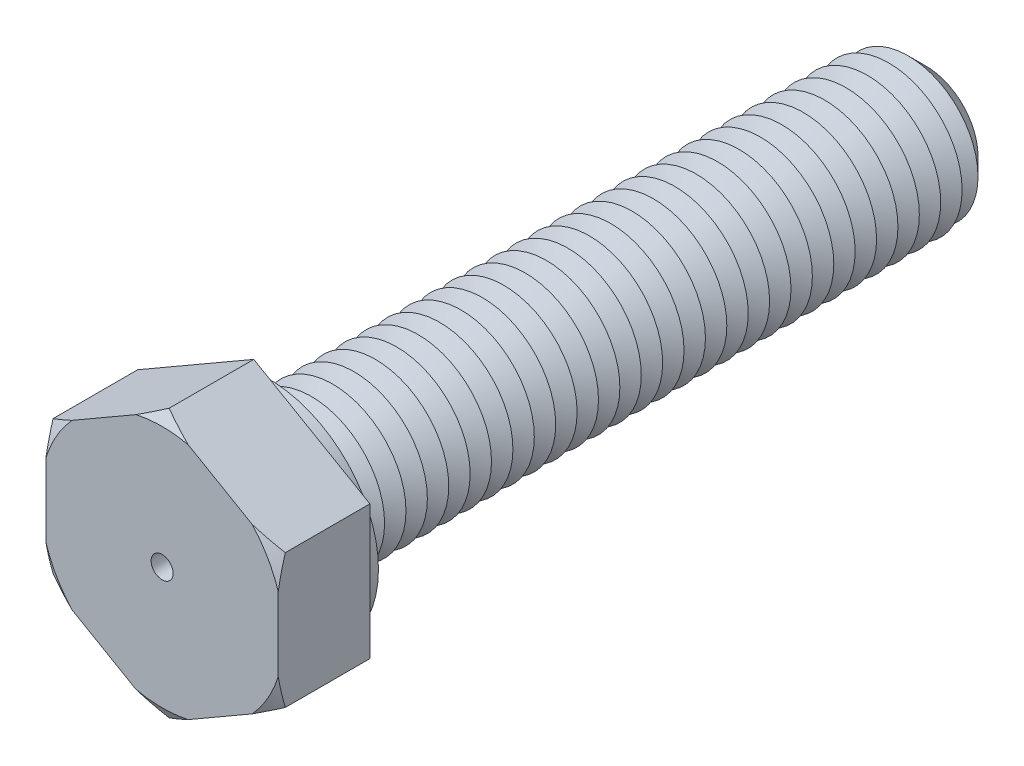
SolidWorks part; units mm, degrees
ref_plane "Front Plane" through (0, 0, 0) normal (0, 0, 1) x (1, 0, 0)
ref_plane "Top Plane" through (0, 0, 0) normal (0, 1, 0) x (1, 0, 0)
ref_plane "Right Plane" through (0, 0, 0) normal (1, 0, 0) x (0, 0, -1)
sketch "Sketch2" plane through (0, 0, 0) normal (0, 0, 1) x (1, 0, 0)
  line L1 (0, 10.9697) -> (-9.5, 5.4848)
  line L2 (-9.5, 5.4848) -> (-9.5, -5.4848)
  line L3 (-9.5, -5.4848) -> (0, -10.9697)
  line L4 (0, -10.9697) -> (9.5, -5.4848)
  line L5 (9.5, -5.4848) -> (9.5, 5.4848)
  line L6 (9.5, 5.4848) -> (0, 10.9697)
  circle A0 centre (0, 0) radius 9.5 construction
  dimension "D1" = 19
extrude "Boss-Extrude1" add sketch "Sketch2" along normal blind 7.5
sketch "Sketch3" plane through (0, 0, 0) normal (0, 0, -1) x (-1, 0, 0)
  circle A0 centre (0, 0) radius 6
  dimension "D1" = 12
extrude "Boss-Extrude2" add sketch "Sketch3" along normal blind 55
sketch "Sketch4" plane through (0, 0, 0) normal (0, 0, -1) x (-1, 0, 0)
  circle A0 centre (0, 0) radius 9
  dimension "D1" = 18
extrude "Boss-Extrude3" add sketch "Sketch4" along normal blind 1.2
sketch "Sketch5" plane through (0, 0, 0) normal (1, 0, 0) x (0, 0, -1)
  line L0 (-3.2117, 0) -> (6.3192, 0) construction
chamfer "Chamfer1" distance 1.75 angle 45 1 edges at (-6, 0, -55)
sketch "Sketch6" plane through (0, 0, 0) normal (1, 0, 0) x (0, 0, -1)
  line L0 (1.2, 6) -> (2.075, 4.4845)
  line L1 (2.075, 4.4845) -> (2.95, 6)
  line L2 (53.25, 6) -> (1.2, 6) construction
  line L3 (2.95, 6) -> (1.2, 6)
  dimension "D1" = 1.75
revolve "Cut-Revolve1" cut sketch "Sketch6" angle 360 about L0
pattern_linear "LPattern1" count 30 spacing 1.75 along (0, 0, -1) of "Cut-Revolve1"
sketch "Sketch7" plane through (0, 0, 0) normal (1, 0, 0) x (0, 0, -1)
  line L0 (-7.5, 10.9697) -> (-7.5, 9.9697)
  line L1 (-7.5, 5.4848) -> (-7.5, 10.9697) construction
  line L2 (-7.5, 9.9697) -> (-6.9226, 10.9697)
  line L3 (-7.5, 10.9697) -> (0, 10.9697) construction
  line L4 (-6.9226, 10.9697) -> (-7.5, 10.9697)
  dimension "D1" = 1
  dimension "D2" = 30
revolve "Cut-Revolve2" cut sketch "Sketch7" angle 360 about L0
sketch "Sketch8" plane through (0, 0, 7.5) normal (0, 0, 1) x (1, 0, 0)
  circle A0 centre (0, 0) radius 0.9
  dimension "D1" = 1.8
extrude "Cut-Extrude1" cut sketch "Sketch8" against normal up to surface (62.5 mm away)
